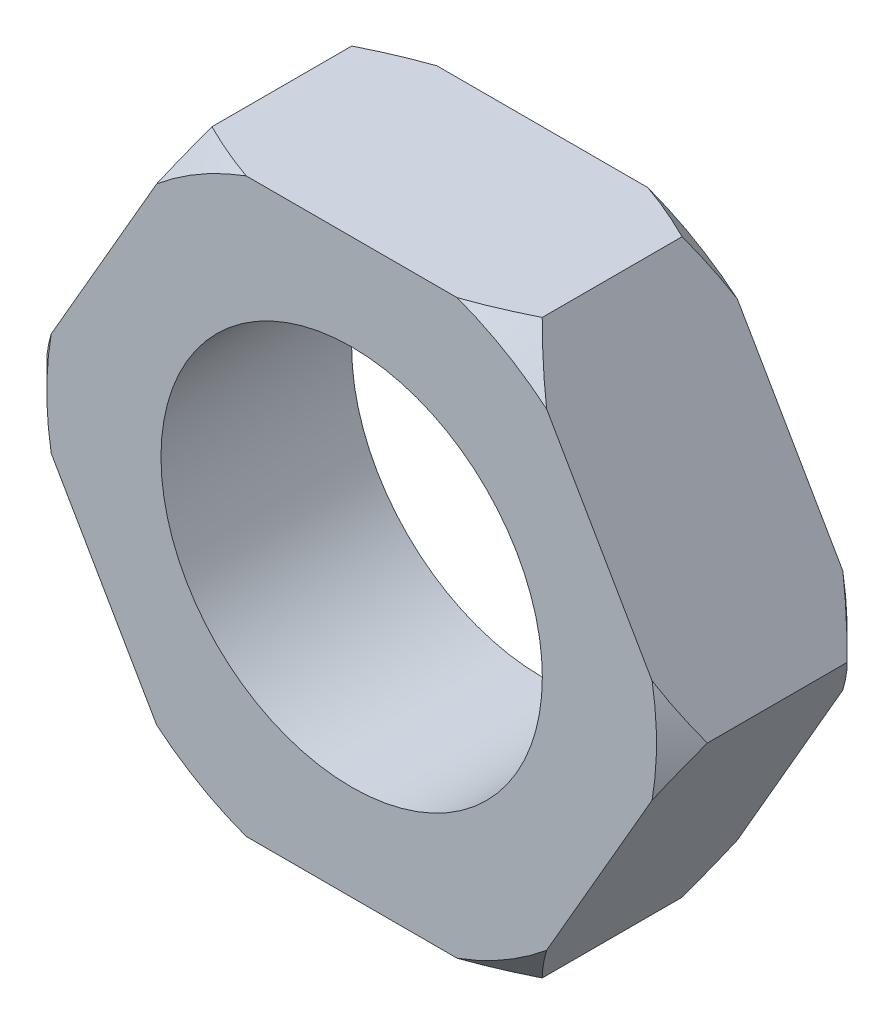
SolidWorks part; units mm, degrees
ref_plane "Face" through (0, 0, 0) normal (0, 0, 1) x (1, 0, 0)
ref_plane "Dessus" through (0, 0, 0) normal (0, 1, 0) x (1, 0, 0)
ref_plane "Droite" through (0, 0, 0) normal (1, 0, 0) x (0, 0, -1)
sketch "Esquisse1" plane through (0, 0, 0) normal (0, 0, 1) x (1, 0, 0)
  line L1 (-2.5981, 4.5) -> (-5.1962, 0)
  line L2 (-5.1962, 0) -> (-2.5981, -4.5)
  line L3 (-2.5981, -4.5) -> (2.5981, -4.5)
  line L4 (2.5981, -4.5) -> (5.1962, 0)
  line L5 (5.1962, 0) -> (2.5981, 4.5)
  line L6 (2.5981, 4.5) -> (-2.5981, 4.5)
  circle A0 centre (0, 0) radius 4.5 construction
  circle A1 centre (0, 0) radius 3
  dimension "D1" = 9
  dimension "D2" = 6
extrude "Base-Extrusion" add sketch "Esquisse1" against normal blind 3
sketch "Esquisse2" plane through (0, 0, 0) normal (0, 1, 0) x (1, 0, 0)
  line L0 (0, 8.9316) -> (0, -2.935) construction
  line L1 (0, 3) -> (0, 0) construction
  line L2 (-5.1962, 3) -> (-4.7962, 3)
  line L3 (-4.7962, 3) -> (-5.1962, 2.6)
  line L4 (-5.1962, 3) -> (-5.1962, 0) construction
  line L5 (-5.1962, 2.6) -> (-5.1962, 3)
  line L6 (-5.1962, 0) -> (-4.7962, 0)
  line L7 (-2.5981, 0) -> (-5.1962, 0) construction
  line L8 (-4.7962, 0) -> (-5.1962, 0.4)
  line L9 (-5.1962, 0.4) -> (-5.1962, 0)
  dimension "D1" = 0.4
  dimension "D2" = 0.4
revolve "Enlèvement de matière-Révolution1" cut sketch "Esquisse2" angle 360 about L0
